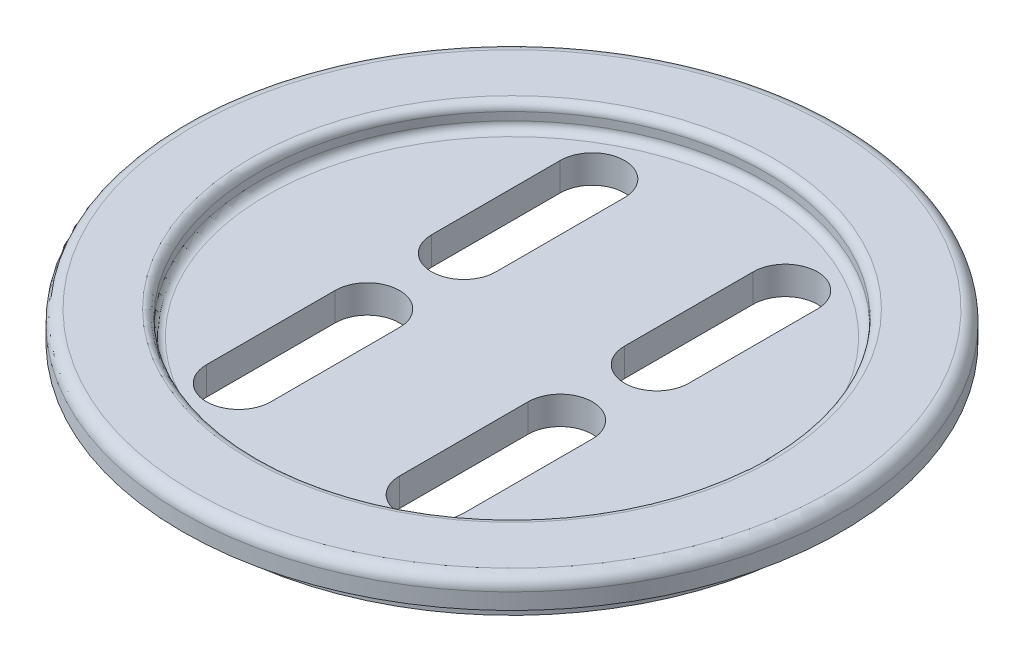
SolidWorks part; units mm, degrees
ref_plane "Front Plane" through (0, 0, 0) normal (0, 0, 1) x (1, 0, 0)
ref_plane "Top Plane" through (0, 0, 0) normal (0, 1, 0) x (1, 0, 0)
ref_plane "Right Plane" through (0, 0, 0) normal (1, 0, 0) x (0, 0, -1)
sketch "Sketch1" plane through (0, 0, 0) normal (0, 1, 0) x (1, 0, 0)
  circle A0 centre (0, 0) radius 41
  dimension "D1" = 82
extrude "Boss-Extrude1" add sketch "Sketch1" along normal blind 3.5
sketch "Sketch2" plane through (0, 0, 0) normal (0, -1, 0) x (1, 0, 0)
  circle A0 centre (0, 0) radius 37.5
  circle A1 centre (0, 0) radius 41 construction
  dimension "D1" = 75
extrude "Boss-Extrude2" add sketch "Sketch2" along normal blind 3
sketch "Sketch3" plane through (0, 3.5, 0) normal (0, 1, 0) x (-1, 0, 0)
  circle A0 centre (0, 0) radius 31.5
  dimension "D1" = 63
extrude "Cut-Extrude1" cut sketch "Sketch3" against normal blind 3
sketch "Sketch4" plane through (0, 0.5, 0) normal (0, 1, 0) x (-1, 0, 0)
  line L0 (0, 0) -> (0, -26.4196) construction
  line L1 (-8, -6) -> (-8, -22)
  line L2 (8, -6) -> (8, -22)
  line L3 (-16, -22) -> (-16, -6)
  line L4 (16, -22) -> (16, -6)
  line L5 (0, 0) -> (-25.9446, 0) construction
  line L6 (16, 22) -> (16, 6)
  line L7 (-16, 22) -> (-16, 6)
  line L8 (8, 6) -> (8, 22)
  line L9 (-8, 6) -> (-8, 22)
  arc A0 (-8, -22) -> (-16, -22) centre (-12, -22) cw
  arc A1 (8, -22) -> (16, -22) centre (12, -22) ccw
  arc A2 (-16, -6) -> (-8, -6) centre (-12, -6) cw
  arc A3 (16, -6) -> (8, -6) centre (12, -6) ccw
  arc A4 (16, 6) -> (8, 6) centre (12, 6) cw
  arc A5 (-16, 6) -> (-8, 6) centre (-12, 6) ccw
  arc A6 (8, 22) -> (16, 22) centre (12, 22) cw
  arc A7 (-8, 22) -> (-16, 22) centre (-12, 22) ccw
  dimension "D1" = 4
  dimension "D2" = 16
  dimension "D3" = 12
  dimension "D4" = 6
extrude "Rounded Slots" cut sketch "Sketch4" against normal through all
fillet "Fillet1" radius 1.5 1 edges at (0, 3.5, 41)
fillet "Fillet2" radius 1 2 edges at (0, 3.5, 31.5) (0, 0.5, 31.5)
